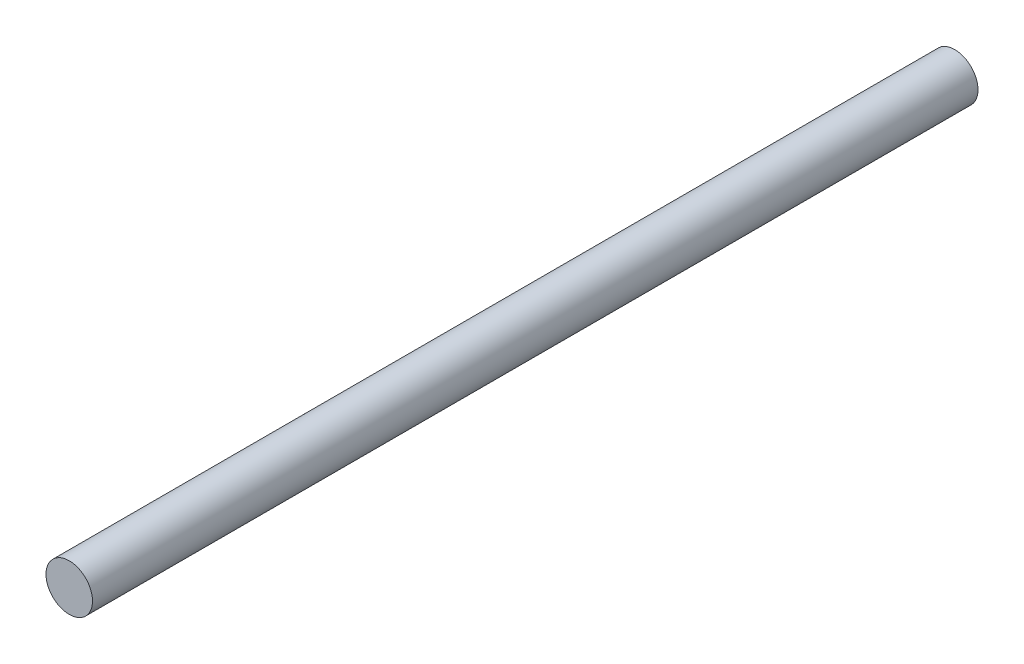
SolidWorks part; units mm, degrees
ref_plane "Plane1" through (0, 0, 0) normal (0, 0, 1) x (1, 0, 0)
ref_plane "Plane2" through (0, 0, 0) normal (0, 1, 0) x (1, 0, 0)
ref_plane "Plane3" through (0, 0, 0) normal (1, 0, 0) x (0, 0, -1)
sketch "Sketch1" plane through (0, 0, 0) normal (0, 0, 1) x (1, 0, 0)
  circle A0 centre (0, 0) radius 18.2562
  dimension "D1" = 36.5125
extrude "Base-Extrude" add sketch "Sketch1" along normal offset from surface 25.4 and the other way offset from surface (347.6625 mm away) 25.4
